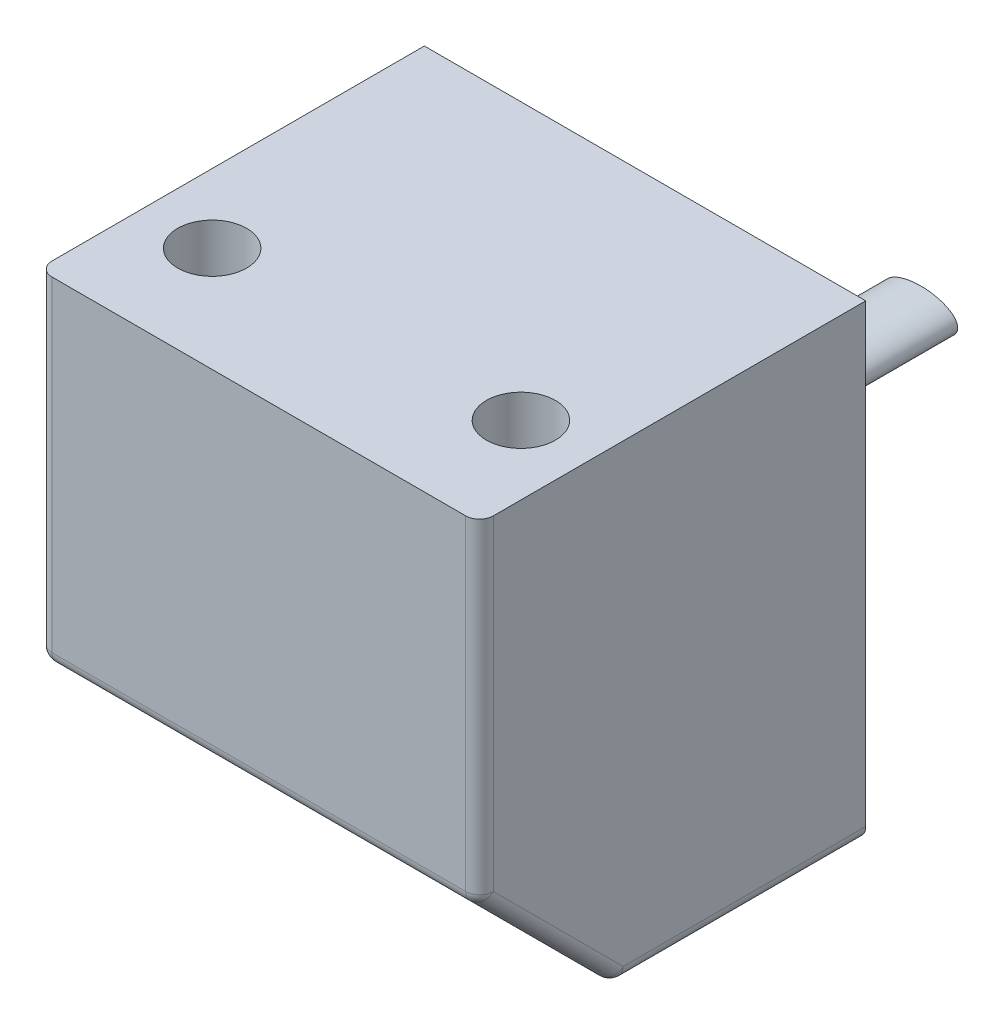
SolidWorks part; units mm, degrees
ref_plane "Face" through (0, 0, 0) normal (0, 0, 1) x (1, 0, 0)
ref_plane "Dessus" through (0, 0, 0) normal (0, 1, 0) x (1, 0, 0)
ref_plane "Droite" through (0, 0, 0) normal (1, 0, 0) x (0, 0, -1)
sketch "Esquisse1" plane through (0, 0, 0) normal (0, 0, 1) x (1, 0, 0)
  line L1 (0, 0) -> (16, 0)
  line L2 (0, 0) -> (0, 17)
  line L3 (0, 17) -> (16, 17)
  line L4 (16, 0) -> (16, 17)
  dimension "D1" = 17
  dimension "D2" = 16
extrude "Extrusion1" add sketch "Esquisse1" along normal blind 14
hole_wizard "Trou taraudé M3x0.51" positions "Esquisse3D1" profile "Esquisse3" tap size "M3x0.5" standard "ISO"
sketch3d "Esquisse3D1"
  line L1 (16, 17, 14) -> (16, 17, 0) construction
  line L3 (16, 17, 0) -> (0, 17, 0) construction
  point P0 (13.5, 17, 10)
  point P1 (2.5017, 17, 10.1939)
  dimension "D1" = 10
  dimension "D2" = 2.5
  dimension "D3" = 11
sketch "Esquisse3" plane through (13.5, 17, 10) normal (1, 0, 0) x (0, 0, 1)
  line L0 (0, 0) -> (0, 6.2511)
  line L1 (0, 6.2511) -> (1.25, 5.5)
  line L2 (1.25, 5.5) -> (1.25, 0)
  line L5 (1.25, 0) -> (0, 0)
  line L10 (0, 6.2511) -> (-1.25, 5.5) construction
  line L11 (0, -6.35) -> (0, 107.95) construction
  dimension "Diamètre du trou pour taraudage" = 2.5
  dimension "Profondeur du trou pour taraudage" = 5.5
  dimension "Angle de pointe" = 118
chamfer "Chanfrein1" distance 5 angle 45
fillet "Congé1" radius 0.5
sketch "Esquisse4" plane through (0, 0, 0) normal (0, 0, -1) x (-1, 0, 0)
  line L2 (0, 17) -> (0, 0.5) construction
  ellipse E1 centre (-8, 7.8153) end of major axis (-6.6648, 7.8153) minor radius 0.6505
  dimension "D1" = 8
extrude "Extrusion4" add sketch "Esquisse4" along normal blind 10
